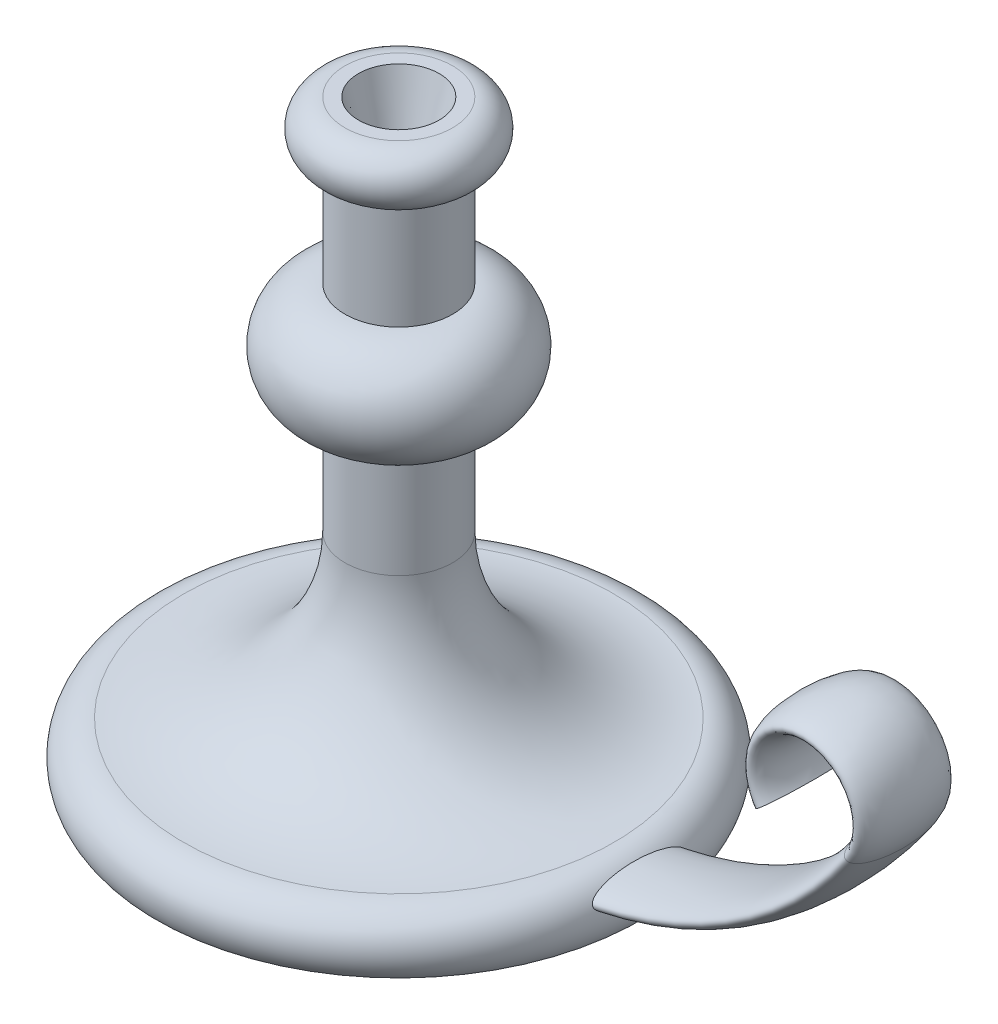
SolidWorks part; units mm, degrees
ref_plane "Front Plane" through (0, 0, 0) normal (0, 0, 1) x (1, 0, 0)
ref_plane "Top Plane" through (0, 0, 0) normal (0, 1, 0) x (1, 0, 0)
ref_plane "Right Plane" through (0, 0, 0) normal (1, 0, 0) x (0, 0, -1)
sketch "Sketch1" plane through (0, 0, 0) normal (0, 0, 1) x (1, 0, 0)
  line L0 (20, 220) -> (0, 220)
  line L1 (0, 220) -> (0, 0)
  line L2 (0, 0) -> (90, 0)
  line L3 (20, 200) -> (20, 160)
  line L4 (20, 120) -> (20, 80)
  arc A0 (20, 220) -> (20, 200) centre (20, 210) cw
  arc A1 (20, 160) -> (20, 120) centre (20, 140) cw
  arc A2 (20, 80) -> (80, 20) centre (80, 80) ccw
  arc A3 (80, 20) -> (90, 0) centre (80, 7.5) cw
  dimension "D4" = 10
  dimension "D5" = 20
  dimension "D7" = 60
  dimension "D8" = 12.5
  dimension "D1" = 20
  dimension "D2" = 220
  dimension "D3" = 90
  dimension "D6" = 40
  dimension "D9" = 80
revolve "Revolve1" add sketch "Sketch1" angle 360 about L1
sketch "Sketch2" plane through (0, 0, 0) normal (0, 0, 1) x (1, 0, 0)
  line L0 (0, 10) -> (60, 10)
  line L1 (0, 160) -> (0, 200) construction
  line L2 (-90, 0) -> (90, 0) construction
  arc A0 (60, 10) -> (183.5921, 75) centre (60, 160) ccw
  arc A1 (183.5921, 75) -> (150.6342, 75) centre (167.1131, 86.3333) ccw
  dimension "D2" = 150
  dimension "D4" = 20
  dimension "D1" = 60
  dimension "D3" = 65
  dimension "D5" = 10
sketch "Sketch3" plane through (0, 0, 0) normal (1, 0, 0) x (0, 0, -1)
  ellipse E0 centre (0, 10) end of major axis (17.5, 10) minor radius 5
  dimension "D1" = 10
  dimension "D2" = 35
sweep "Sweep1" add profiles "Sketch3" path "Sketch2"
sketch "Sketch4" plane through (0, 220, 0) normal (0, 1, 0) x (1, 0, 0)
  circle A0 centre (0, 0) radius 15
  dimension "D1" = 30
extrude "Cut-Extrude1" cut sketch "Sketch4" against normal blind 25 draft 15
